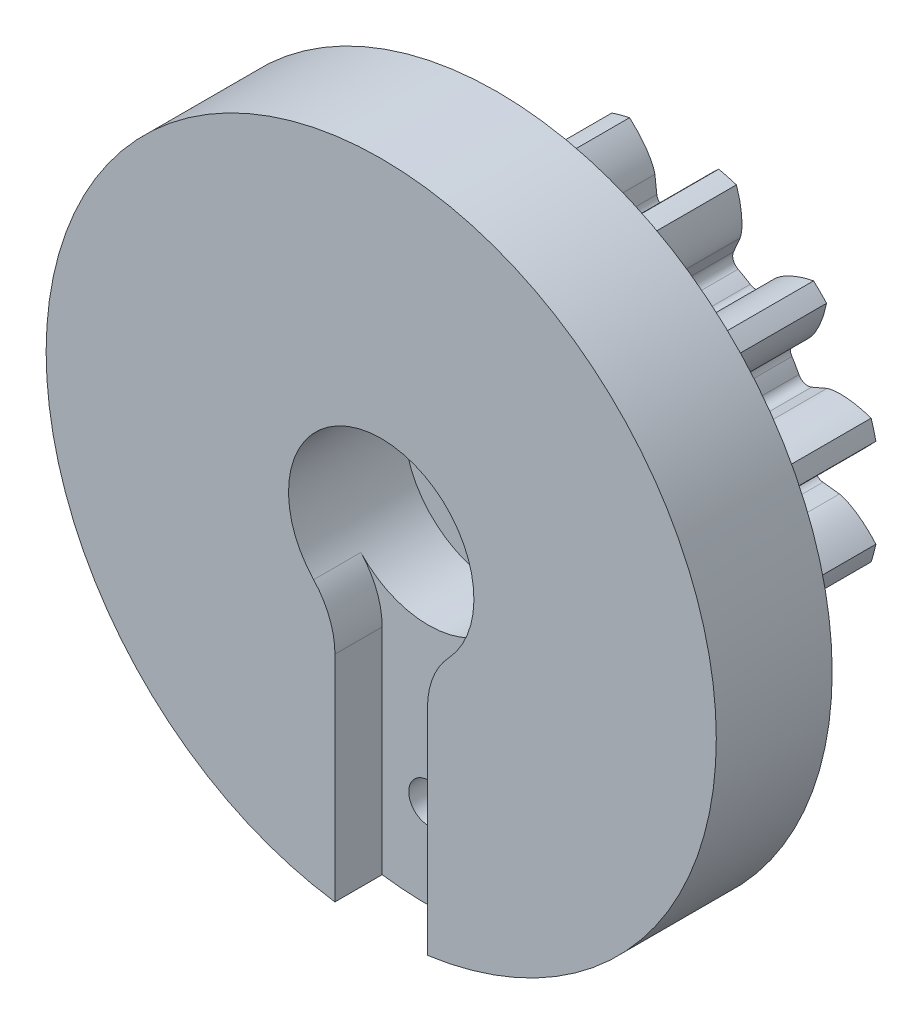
SolidWorks part; units mm, degrees
ref_plane "Front Plane" through (0, 0, 0) normal (0, 0, 1) x (1, 0, 0)
ref_plane "Top Plane" through (0, 0, 0) normal (0, 1, 0) x (1, 0, 0)
ref_plane "Right Plane" through (0, 0, 0) normal (1, 0, 0) x (0, 0, -1)
sketch "Sketch1" plane through (0, 0, 0) normal (0, 0, 1) x (1, 0, 0)
  line L0 (0, 0) -> (0, 6.35) construction
  line L1 (-2.0409, 7.0928) -> (2.0409, 5.6072) construction
  circle A0 centre (0, 0) radius 5.0271 construction
  circle A1 centre (0, 0) radius 7.4083 construction
  circle A2 centre (0, 0) radius 6.35 construction
  circle A3 centre (0, 0) radius 5.967 construction
  circle A4 centre (0, 0) radius 2.3813 construction
  circle A5 centre (0, 0) radius 4.826 construction
  point P8 (304.8, 0)
  point P13 (152.4, 0)
sketch "Sketch2" plane through (0, 0, 0) normal (1, 0, 0) x (0, 0, -1)
  line L0 (-6.35, 0) -> (6.35, 0) construction
  line L1 (-6.35, 7.4083) -> (6.35, 7.4083) construction
  point P2 (0, 7.4083)
  point P4 (0, 0)
  point P6 (0, 7.4083)
  dimension "Overall Width" = 12.7
  dimension "Hub Width" = 6.35
  dimension "Face Width" = 6.35
sketch "Sketch3" plane through (0, 0, 0) normal (0, 0, 1) x (1, 0, 0)
  circle A0 centre (0, 0) radius 7.4083
  circle A1 centre (0, 0) radius 7.4083 construction
extrude "Boss-Extrude1" add sketch "Sketch3" against normal up to vertex (6.35 mm away) and the other way up to vertex (6.35 mm away)
sketch "Sketch5" plane through (0, 0, 0) normal (1, 0, 0) x (0, 0, -1)
  line L1 (-6.35, 7.4083) -> (0, 7.4083)
  line L2 (-6.35, 7.4083) -> (-6.35, 4.826)
  line L3 (-6.35, 4.826) -> (0, 4.826)
  line L4 (0, 7.4083) -> (0, 4.826)
  line L11 (6.35, 2.3813) -> (-6.35, 2.3812)
  line L12 (6.35, 2.3813) -> (6.35, 0)
  line L13 (6.35, 0) -> (-6.35, 0)
  line L14 (-6.35, 2.3812) -> (-6.35, 0)
  point P5 (0, 2.3813)
  point P12 (0, 4.826)
revolve "Cut-Revolve1" cut sketch "Sketch5" angle 360 about L0
sketch "Sketch4" plane through (0, 0, 0) normal (0, 0, 1) x (1, 0, 0)
  line L0 (0, 0) -> (4.9933, 0.5818) construction
  line L2 (0, 0) -> (4.9933, -0.5818) construction
  line L4 (4.9933, 0.5818) -> (5.927, 0.6906)
  line L5 (5.927, -0.6906) -> (4.9933, -0.5818)
  arc A0 (4.9933, 0.5818) -> (4.9933, -0.5818) centre (0, 0) cw
  arc A3 (7.2339, 1.5983) -> (7.2339, -1.5983) centre (0, 0) cw
  circle A4 centre (0, 0) radius 7.4083 construction
  spline S0 degree 4 poles (5.927, 0.6906) (5.9293, 0.6909) (5.9359, 0.6919) (5.9484, 0.6942) (5.9686, 0.6987) (5.9942, 0.7052) (6.0271, 0.7148) (6.0655, 0.7275) (6.1073, 0.7428) (6.1523, 0.761) (6.1969, 0.7804) (6.2409, 0.8011) (6.2844, 0.8228) (6.3367, 0.8503) (6.3986, 0.8852) (6.47, 0.9285) (6.5497, 0.9807) (6.6294, 1.0371) (6.7066, 1.0952) (6.7832, 1.1568) (6.8562, 1.2185) (6.9304, 1.2856) (6.9981, 1.3489) (7.0721, 1.4232) (7.1312, 1.484) (7.2071, 1.5675) (7.2513, 1.6179) (7.3023, 1.6779) (7.3245, 1.7051) (7.3382, 1.7219) knots 0 0 0 0 0 0.005377 0.015084 0.028532 0.04661 0.064855 0.092111 0.119476 0.146842 0.174209 0.201575 0.228941 0.256307 0.307035 0.361767 0.4165 0.471232 0.525964 0.580697 0.635429 0.690161 0.744894 0.799626 0.854358 0.909091 0.954545 1 1 1 1 1 construction
  spline S1 degree 4 poles (5.927, 0.6906) (5.9293, 0.6909) (5.9359, 0.6919) (5.9484, 0.6942) (5.9686, 0.6987) (5.9942, 0.7052) (6.0271, 0.7148) (6.0655, 0.7275) (6.1073, 0.7428) (6.1523, 0.761) (6.1969, 0.7804) (6.2409, 0.8011) (6.2844, 0.8228) (6.3367, 0.8503) (6.3986, 0.8852) (6.47, 0.9285) (6.5497, 0.9807) (6.6294, 1.0371) (6.7066, 1.0952) (6.7832, 1.1568) (6.8562, 1.2185) (6.9304, 1.2856) (6.9981, 1.3489) (7.0721, 1.4232) (7.1312, 1.484) (7.1906, 1.5494) (7.2193, 1.5816) (7.2339, 1.5983) knots 0 0 0 0 0 0.005377 0.015084 0.028532 0.04661 0.064855 0.092111 0.119476 0.146842 0.174209 0.201575 0.228941 0.256307 0.307035 0.361767 0.4165 0.471232 0.525964 0.580697 0.635429 0.690161 0.744894 0.799626 0.854358 0.909091 0.909091 0.909091 0.909091 0.909091
  spline S2 degree 4 poles (5.927, -0.6906) (5.9293, -0.6909) (5.9359, -0.6919) (5.9484, -0.6942) (5.9686, -0.6987) (5.9942, -0.7052) (6.0271, -0.7148) (6.0655, -0.7275) (6.1073, -0.7428) (6.1523, -0.761) (6.1969, -0.7804) (6.2409, -0.8011) (6.2844, -0.8228) (6.3367, -0.8503) (6.3986, -0.8852) (6.47, -0.9285) (6.5497, -0.9807) (6.6294, -1.0371) (6.7066, -1.0952) (6.7832, -1.1568) (6.8562, -1.2185) (6.9304, -1.2856) (6.9981, -1.3489) (7.0721, -1.4232) (7.1312, -1.484) (7.2071, -1.5675) (7.2513, -1.6179) (7.3023, -1.6779) (7.3245, -1.7051) (7.3382, -1.7219) knots 0 0 0 0 0 0.005377 0.015084 0.028532 0.04661 0.064855 0.092111 0.119476 0.146842 0.174209 0.201575 0.228941 0.256307 0.307035 0.361767 0.4165 0.471232 0.525964 0.580697 0.635429 0.690161 0.744894 0.799626 0.854358 0.909091 0.954545 1 1 1 1 1 construction
  spline S3 degree 4 poles (5.927, -0.6906) (5.9293, -0.6909) (5.9359, -0.6919) (5.9484, -0.6942) (5.9686, -0.6987) (5.9942, -0.7052) (6.0271, -0.7148) (6.0655, -0.7275) (6.1073, -0.7428) (6.1523, -0.761) (6.1969, -0.7804) (6.2409, -0.8011) (6.2844, -0.8228) (6.3367, -0.8503) (6.3986, -0.8852) (6.47, -0.9285) (6.5497, -0.9807) (6.6294, -1.0371) (6.7066, -1.0952) (6.7832, -1.1568) (6.8562, -1.2185) (6.9304, -1.2856) (6.9981, -1.3489) (7.0721, -1.4232) (7.1312, -1.484) (7.1906, -1.5494) (7.2193, -1.5816) (7.2339, -1.5983) knots 0 0 0 0 0 0.005377 0.015084 0.028532 0.04661 0.064855 0.092111 0.119476 0.146842 0.174209 0.201575 0.228941 0.256307 0.307035 0.361767 0.4165 0.471232 0.525964 0.580697 0.635429 0.690161 0.744894 0.799626 0.854358 0.909091 0.909091 0.909091 0.909091 0.909091
extrude "Cut-Extrude1" cut sketch "Sketch4" against normal through all both and the other way through all
fillet "Fillet1" radius 0.3551 2 edges at (4.9933, -0.5818, -3.175) (4.9933, 0.5818, -3.175)
pattern_circular "CirPattern1" count 12 over 360 about axis through (0, 0, 6.35) along (0, 0, -1) of "Cut-Extrude1", "Fillet1"
sketch "Sketch6" plane through (0, 0, 6.35) normal (0, 0, 1) x (1, 0, 0)
  circle A0 centre (0, 0) radius 9.1604
extrude "Cut-Extrude2" cut sketch "Sketch6" against normal up to surface (6.35 mm away)
scale "Scale1" scale about centroid uniform scaling yes scale factor 2.25
sketch "Sketch7" plane through (0, 0, 3.9687) normal (0, 0, 1) x (1, 0, 0)
  line L2 (3.7338, -6.4818) -> (3.7338, -24.0919) construction
  arc A0 (3.7338, -26.7793) -> (-3.7338, -26.7793) centre (0, 0) ccw
  arc A1 (-3.0099, -24.0284) -> (3.0099, -24.0284) centre (0, -24.0284) ccw construction
  arc A5 (3.7338, -6.4818) -> (-3.7338, -6.4818) centre (0, 0) ccw
  arc A6 (-3.7338, -26.7793) -> (3.7338, -26.7793) centre (0, 0) ccw
  arc A7 (-3.7338, -6.4818) -> (3.7338, -6.4818) centre (0, 0) ccw
  circle A8 centre (0, -19.9009) radius 2.75
  dimension "D1" = 5.5
extrude "Boss-Extrude4" add sketch "Sketch7" along normal blind 3
sketch "Sketch10" plane through (0, 0, 6.9687) normal (0, 0, 1) x (1, 0, 0)
  circle A3 centre (0, 0) radius 27.0383
  circle A6 centre (0, 0) radius 7.4803
  circle A7 centre (0, -19.9009) radius 1.5875
  dimension "D1" = 3.175
extrude "Boss-Extrude5" add sketch "Sketch10" along normal blind 2.54
sketch "Sketch12" plane through (0, 0, 9.5087) normal (0, 0, 1) x (1, 0, 0)
  line L0 (-3.7338, -24.0919) -> (-3.7338, -6.4818) construction
  line L1 (3.7338, -6.4818) -> (3.7338, -24.0919) construction
  line L3 (-6.4499, 28.1571) -> (-4.2106, 23.4562) construction
  line L4 (3.7338, -9.4654) -> (3.7338, -26.7793)
  line L5 (-3.7338, -9.4654) -> (-3.7338, -26.7793)
  arc A0 (-5.454, -5.1195) -> (5.454, -5.1195) centre (0, 0) cw
  circle A1 centre (0, 0) radius 7.4803 construction
  circle A2 centre (0, 0) radius 27.0383 construction
  arc A3 (3.7338, -26.7793) -> (-5.6342, 26.4448) centre (0, 0) ccw
  arc A6 (-5.6342, 26.4448) -> (-3.7338, -26.7793) centre (0, 0) ccw
  arc A7 (3.7338, -9.4654) -> (5.454, -5.1195) centre (10.0838, -9.4654) cw
  arc A8 (-5.454, -5.1195) -> (-3.7338, -9.4654) centre (-10.0838, -9.4654) cw
  point P19 (3.7338, -6.4818)
  point P22 (-3.7338, -6.4818)
  point P23 (3.7338, -6.4818)
  point P26 (-3.7338, -6.4818)
  dimension "D1" = 6.35
extrude "Boss-Extrude6" add sketch "Sketch12" along normal blind 3.81
sketch "Sketch13" plane through (0, 0, -10.3188) normal (0, 0, -1) x (-1, 0, 0)
  circle A0 centre (0, 0) radius 14.2875
  dimension "D1" = 28.575
equation "\"Root Diameter@Sketch1\"=\"Root Diameter\""
equation "\"OD | Outside Diameter@Sketch1\"=\"Outside Diameter\""
equation "\"D1@CirPattern1\"=\"Number of Teeth\""
equation "\"Diametral Pitch\"= 24"
equation "\"Number of Teeth\"= 12"
equation "\"Pressure Angle\"=20"
equation "\"Pitch Diameter\"= \"Number of Teeth\" / \"Diametral Pitch\""
equation "\"Base Diameter\"= \"Pitch Diameter\" * cos ( \"Pressure Angle\" )"
equation "\"Outside Diameter\"= ( \"Number of Teeth\" + 2 ) / \"Diametral Pitch\""
equation "\"Dedendum\"= 1.25 / \"Diametral Pitch\""
equation "\"Root Diameter\"= \"Pitch Diameter\" - ( 2 * \"Dedendum\" )"
equation "\"Pitch Angle\"= 360deg / \"Number of Teeth\""
equation "\"Alpha\"= sqr ( \"Pitch Diameter\" ^ 2 - \"Base Diameter\" ^ 2 ) / \"Base Diameter\" * 180 / PI - \"Pressure Angle\""
equation "\"Beta\"= ( \"Pitch Angle\" / 4 - \"Alpha\" )"
equation "\"Phi\"= sqr ( ( \"Outside Diameter\" / 2 ) ^ 2 - ( \"Base Diameter\" / 2 ) ^ 2 ) / ( \"Base Diameter\" / 2 )"
equation "\"Addendum\"= 1 / \"Diametral Pitch\""
equation "\"WorkingDepth\"= 2 / \"Diametral Pitch\""
equation "\"WholeDepth\"= 2.25 / \"Diametral Pitch\""
equation "\"Clearance\"= 0.25 / \"Diametral Pitch\""
equation "\"ToothThickness\"= ( pi * 2 ) / \"Diametral Pitch\""
equation "\"CircularPitch\"= pi / \"Diametral Pitch\""
equation "\"Number of Teeth@Sketch1\"=\"Number of Teeth\""
equation "\"Gear Pitch | Diametral Pitch@Sketch1\"=\"Diametral Pitch\""
equation "\"Pressure Angle@Sketch1\"=\"Pressure Angle\""
equation "\"Gear Pitch Diameter@Sketch1\"=\"Pitch Diameter\""
equation "\"Base Diameter@Sketch1\"=\"Base Diameter\""
equation "\"Fillet\"= \"Clearance\" * cos ( \"Pressure Angle\" ) * tan ( ( 90 + \"Pressure Angle\" ) / 2 )"
equation "\"D1@Fillet1\"=\"Fillet\""
equation "\"D1@Sketch4\"=if( \"Base Diameter\">\"Root Diameter\",\"Root Diameter\",\"Base Diameter\"-.00001)"
equation "\"D1@Fillet2\"=\"Fillet\""
